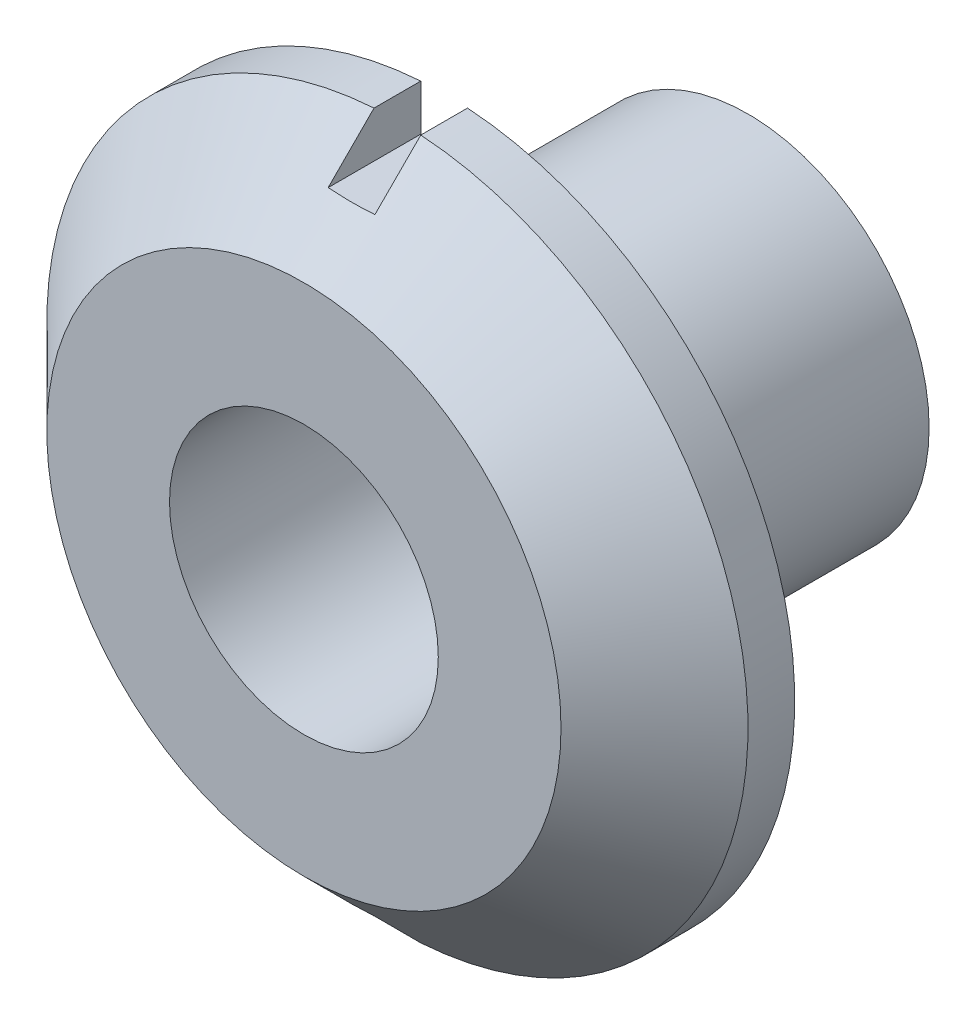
SolidWorks part; units mm, degrees
ref_plane "Alzado" through (0, 0, 0) normal (0, 0, 1) x (1, 0, 0)
ref_plane "Planta" through (0, 0, 0) normal (0, 1, 0) x (1, 0, 0)
ref_plane "Vista lateral" through (0, 0, 0) normal (1, 0, 0) x (0, 0, -1)
sketch "Croquis1" plane through (0, 0, 0) normal (0, 0, 1) x (1, 0, 0)
  circle A0 centre (0, 0) radius 7.5
  circle A1 centre (0, 0) radius 1.55
  dimension "D1" = 15
  dimension "D2" = 3.1
extrude "Saliente-Extruir1" add sketch "Croquis1" along normal mid plane 3
chamfer "Chaflán1" distance 2 angle 45 1 edges at (7.5, 0, 1.5)
sketch "Croquis2" plane through (0, 0, -1.5) normal (0, 0, -1) x (-1, 0, 0)
  circle A2 centre (0, 0) radius 1.55 construction
  circle A3 centre (0, 0) radius 1.55
  circle A4 centre (0, 0) radius 3.875
  dimension "D1" = 7.75
extrude "Saliente-Extruir2" add sketch "Croquis2" along normal blind 6.5
sketch "Croquis3" plane through (0, 0, 1.5) normal (0, 0, 1) x (1, 0, 0)
  circle A0 centre (0, 0) radius 2.875
  dimension "D1" = 5.75
extrude "Cortar-Extruir1" cut sketch "Croquis3" against normal offset from surface (6.5 mm away) 3
sketch "Croquis4" plane through (0, 0, 1.5) normal (0, 0, 1) x (1, 0, 0)
  line L1 (-0.5, 8.5) -> (0.5, 8.5)
  line L2 (-0.5, 8.5) -> (-0.5, 6.5)
  line L3 (-0.5, 6.5) -> (0.5, 6.5)
  line L4 (0.5, 8.5) -> (0.5, 6.5)
  line L5 (-0.5, 8.5) -> (0.5, 6.5) construction
  line L6 (-0.5, 6.5) -> (0.5, 8.5) construction
  line L7 (-0.5, -6.5) -> (0.5, -6.5)
  line L8 (-0.5, -6.5) -> (-0.5, -8.5)
  line L9 (-0.5, -8.5) -> (0.5, -8.5)
  line L10 (0.5, -6.5) -> (0.5, -8.5)
  line L11 (-0.5, -6.5) -> (0.5, -8.5) construction
  line L12 (-0.5, -8.5) -> (0.5, -6.5) construction
  circle A0 centre (0, 0) radius 7.5 construction
  point P0 (0, 7.5)
  point P7 (0, -7.5)
  dimension "D1" = 1
  dimension "D2" = 2
extrude "Cortar-Extruir2" cut sketch "Croquis4" against normal through all
